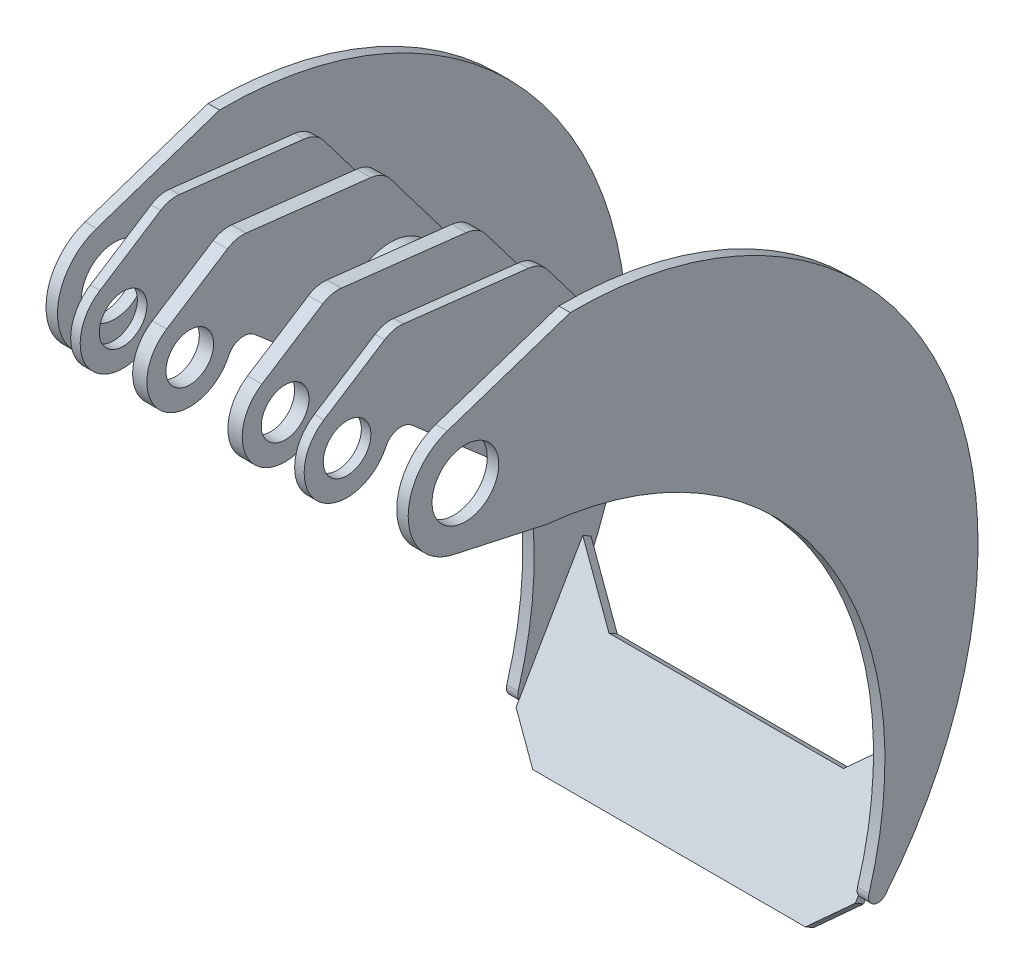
SolidWorks part; units mm, degrees
ref_plane "Ebene vorne" through (0, 0, 0) normal (0, 0, 1) x (1, 0, 0)
ref_plane "Ebene oben" through (0, 0, 0) normal (0, 1, 0) x (1, 0, 0)
ref_plane "Ebene rechts" through (0, 0, 0) normal (1, 0, 0) x (0, 0, -1)
sketch "Skizze1" plane through (0, 0, 0) normal (1, 0, 0) x (0, 0, -1)
  line L0 (-19.0085, 56.9094) -> (110, 100)
  line L1 (85, -80) -> (-12.8147, -58.6156)
  line L2 (0, 215) -> (0, -403.5076) construction
  line L3 (-634, 215) -> (-634, -403.5076) construction
  line L4 (-317, 60) -> (-317, -406.0306) construction
  line L5 (-1057, -221.2221) -> (-1057, -820.6828) construction
  line L6 (423, -221.2221) -> (423, -746.5071) construction
  line L7 (-664.6935, 100) -> (520.6037, 100) construction
  line L8 (-664.6935, 215) -> (531.2003, 215) construction
  line L9 (-811.8338, -695) -> (796.9006, -695) construction
  circle A0 centre (0, 0) radius 35
  arc A1 (-19.0085, 56.9094) -> (-12.8147, -58.6156) centre (0, 0) ccw
  arc A3 (423.4272, -584.825) -> (440.7083, -594.0872) centre (433, -587.7168) ccw
  circle A7 centre (0, 0) radius 730 construction
  arc A8 (110, 100) -> (440.7083, -594.0872) centre (113.876, -323.9823) cw
  arc A9 (423.4272, -584.825) -> (85, -80) centre (47.2176, -471.1796) ccw
  point P18 (-634, 0)
  dimension "D1" = 70
  dimension "D2" = 60
  dimension "D8" = 10
  dimension "D9" = 1460
  dimension "D11" = 110
  dimension "D13" = 424
  dimension "D14" = 393
  dimension "D3" = 634
  dimension "D4" = 1480
  dimension "D5" = 100
  dimension "D6" = 115
  dimension "D7" = 910
  dimension "D10" = 180
  dimension "D12" = 85
extrude "Aufsatz-Linear austragen1" add sketch "Skizze1" along normal blind 12
sketch "Skizze2" plane through (12, 0, 0) normal (1, 0, 0) x (0, 0, -1)
  line L0 (412.3301, -633.518) -> (499.8301, -481.9636)
  line L1 (412.3301, -633.518) -> (403.6699, -628.518)
  line L2 (499.8301, -481.9636) -> (491.1699, -476.9636)
  line L3 (403.6699, -628.518) -> (491.1699, -476.9636)
  line L4 (495.5, -479.4636) -> (408, -631.018) construction
  line L6 (423, -221.2221) -> (423, -746.5071) construction
  point P1 (433, -587.7168)
  dimension "D1" = 10
  dimension "D2" = 50
  dimension "D3" = 30
  dimension "D4" = 125
extrude "Aufsatz-Linear austragen2" add sketch "Skizze2" along normal blind 356
sketch "Skizze3" plane through (368, 0, 0) normal (1, 0, 0) x (0, 0, -1)
  line L5 (424.3397, -592.7168) -> (491.1699, -476.9636)
  line L6 (491.1699, -476.9636) -> (499.8301, -481.9636)
  line L7 (499.8301, -481.9636) -> (433, -597.7168)
  line L8 (110, 100) -> (-19.0085, 56.9094)
  line L9 (-12.8147, -58.6156) -> (85, -80)
  line L13 (110, 100) -> (-19.0085, 56.9094)
  line L14 (-12.8147, -58.6156) -> (85, -80)
  circle A0 centre (0, 0) radius 35 construction
  circle A1 centre (0, 0) radius 35
  arc A5 (433, -597.7168) -> (440.7083, -594.0872) centre (433, -587.7168) ccw
  arc A6 (440.7083, -594.0872) -> (110, 100) centre (113.876, -323.9823) ccw
  arc A7 (-19.0085, 56.9094) -> (-12.8147, -58.6156) centre (0, 0) ccw
  arc A8 (423.4272, -584.825) -> (85, -80) centre (47.2176, -471.1796) ccw
  arc A9 (423.4272, -584.825) -> (424.3397, -592.7168) centre (433, -587.7168) ccw
  arc A10 (423.4272, -584.825) -> (440.7083, -594.0872) centre (433, -587.7168) ccw
  arc A11 (440.7083, -594.0872) -> (110, 100) centre (113.876, -323.9823) ccw
  arc A12 (-19.0085, 56.9094) -> (-12.8147, -58.6156) centre (0, 0) ccw
  arc A13 (423.4272, -584.825) -> (85, -80) centre (47.2176, -471.1796) ccw
  dimension "D1" = 0
extrude "Aufsatz-Linear austragen3" add sketch "Skizze3" along normal blind 12
chamfer "Fase1" distance 35 angle 45 2 edges at (12, -631.018, -408) (368, -631.018, -408)
sketch "Skizze4" plane through (0, -336.9237, -583.569) normal (0, -0.5, -0.866) x (-1, 0, 0)
  line L3 (-368, -307.4777) -> (-333, -342.4777) construction
  line L5 (-47, -342.4777) -> (-12, -307.4777) construction
  line L6 (-333, -342.4777) -> (-47, -342.4777) construction
  line L9 (-67, -222.4777) -> (-12, -167.4777)
  line L10 (-368, -167.4777) -> (-313, -222.4777)
  line L11 (-313, -222.4777) -> (-67, -222.4777)
  dimension "D1" = 120
extrude "Schnitt-Linear austragen1" cut sketch "Skizze4" against normal blind 10 and the other way through all
sketch "Skizze6" plane through (12, 0, 0) normal (1, 0, 0) x (0, 0, -1)
  circle A0 centre (153.8245, -24.3092) radius 50
  circle A1 centre (153.8245, -24.3092) radius 42
  circle A2 centre (0, 0) radius 155.7335 construction
  point P4 (153.8245, -24.3092)
  dimension "D1" = 100
  dimension "D2" = 8
  dimension "D3" = 311.4669
extrude "Aufsatz-Linear austragen8" add sketch "Skizze6" along normal up to next
ref_plane "Mitte" through (190, 0, 0) normal (1, 0, 0) x (0, 0, -1)
ref_plane "Ebene2" through (247.5, 0, 0) normal (1, 0, 0) x (0, 0, -1)
sketch "Skizze8" plane through (247.5, 0, 0) normal (1, 0, 0) x (0, 0, -1)
  line L0 (205.6078, 14.9781) -> (153.9, 83.1326)
  line L1 (133.4114, 94.8054) -> (2.4114, 109.7992)
  line L2 (-17.2162, 105.2333) -> (-80.9685, 64.273)
  line L4 (11.4739, 13.2136) -> (111.2072, -73.3884)
  line L5 (0, 0) -> (-56.6442, 26.4136) construction
  line L8 (0, 64.1869) -> (0, -109.0364) construction
  circle A0 centre (153.8245, -24.3092) radius 50 construction
  circle A1 centre (153.8245, -24.3092) radius 50
  arc A2 (111.2072, -73.3884) -> (205.6078, 14.9781) centre (153.8245, -24.3092) ccw
  arc A3 (-80.9685, 64.273) -> (-15.8604, 7.3958) centre (-56.6442, 26.4136) ccw
  arc A4 (-15.8604, 7.3958) -> (11.4739, 13.2136) centre (0, 0) cw
  arc A5 (2.4114, 109.7992) -> (-17.2162, 105.2333) centre (-1, 79.9937) ccw
  arc A6 (153.9, 83.1326) -> (133.4114, 94.8054) centre (130, 65) ccw
  circle A7 centre (-56.6442, 26.4136) radius 25
  circle A8 centre (0, 0) radius 62.5 construction
  circle A10 centre (0, 0) radius 62 construction
  point P37 (-56.6442, 26.4136)
  dimension "D1" = 45
  dimension "D2" = 124
  dimension "D3" = 30
  dimension "D7" = 50
  dimension "D8" = 65
  dimension "D4" = 125
  dimension "D9" = 130
  dimension "D5" = 80
  dimension "D6" = 1
  dimension "D10" = 65
  dimension "D11" = 65
extrude "Aufsatz-Linear austragen9" add sketch "Skizze8" against normal blind 15
ref_plane "Ebene3" through (312.5, 0, 0) normal (-1, 0, 0) x (0, 0, 1)
sketch "Skizze9" plane through (312.5, 0, 0) normal (-1, 0, 0) x (0, 0, 1)
  line L4 (-111.2072, -73.3884) -> (-11.4739, 13.2136)
  line L5 (-153.9, 83.1326) -> (-205.6078, 14.9781)
  line L6 (-2.4114, 109.7992) -> (-133.4114, 94.8054)
  line L7 (80.9685, 64.273) -> (17.2162, 105.2333)
  line L8 (-111.2072, -73.3884) -> (-11.4739, 13.2136)
  line L9 (-153.9, 83.1326) -> (-205.6078, 14.9781)
  line L10 (-2.4114, 109.7992) -> (-133.4114, 94.8054)
  line L11 (80.9685, 64.273) -> (17.2162, 105.2333)
  circle A0 centre (-153.8245, -24.3092) radius 50 construction
  circle A1 centre (-153.8245, -24.3092) radius 50
  circle A2 centre (56.6442, 26.4136) radius 25 construction
  circle A3 centre (56.6442, 26.4136) radius 25
  arc A5 (15.8604, 7.3958) -> (-11.4739, 13.2136) centre (0, 0) ccw
  arc A6 (-205.6078, 14.9781) -> (-111.2072, -73.3884) centre (-153.8245, -24.3092) ccw
  arc A7 (-133.4114, 94.8054) -> (-153.9, 83.1326) centre (-130, 65) ccw
  arc A8 (17.2162, 105.2333) -> (-2.4114, 109.7992) centre (1, 79.9937) ccw
  arc A9 (15.8604, 7.3958) -> (80.9685, 64.273) centre (56.6442, 26.4136) ccw
  arc A10 (15.8604, 7.3958) -> (-11.4739, 13.2136) centre (0, 0) ccw
  arc A11 (-205.6078, 14.9781) -> (-111.2072, -73.3884) centre (-153.8245, -24.3092) ccw
  arc A12 (-133.4114, 94.8054) -> (-153.9, 83.1326) centre (-130, 65) ccw
  arc A13 (17.2162, 105.2333) -> (-2.4114, 109.7992) centre (1, 79.9937) ccw
  arc A14 (15.8604, 7.3958) -> (80.9685, 64.273) centre (56.6442, 26.4136) ccw
  dimension "D1" = 0
extrude "Aufsatz-Linear austragen10" add sketch "Skizze9" along normal blind 10
mirror "Spiegeln2" about plane through (190, 0, 0) normal (1, 0, 0) of "Aufsatz-Linear austragen10", "Aufsatz-Linear austragen9"
